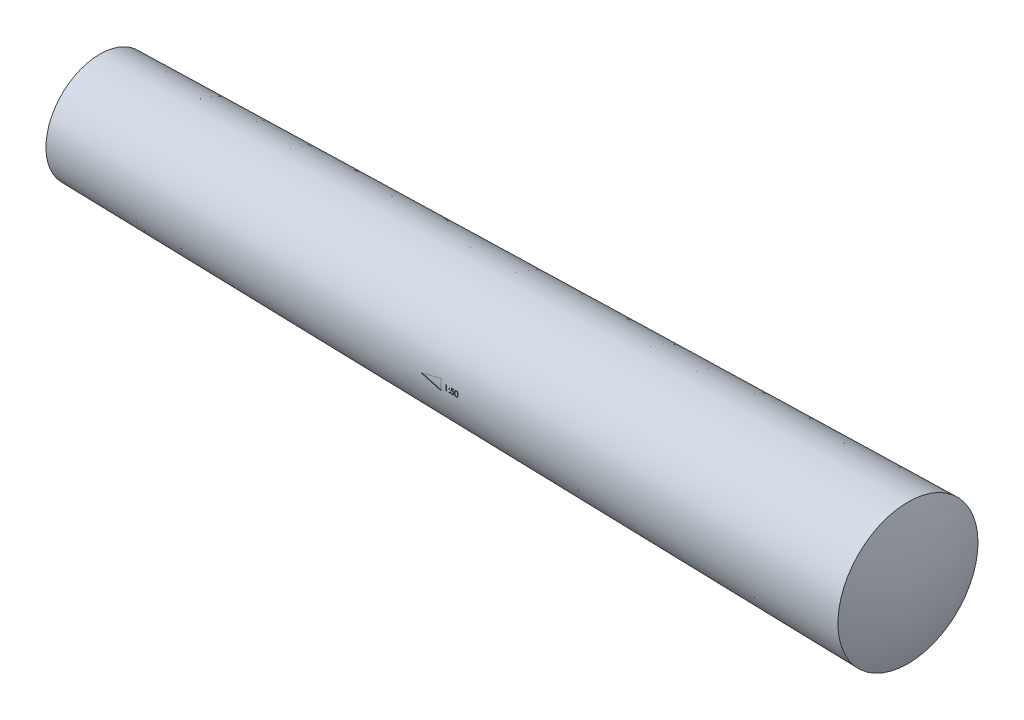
SolidWorks part; units mm, degrees
ref_plane "Front Plane" through (0, 0, 0) normal (0, 0, 1) x (1, 0, 0)
ref_plane "Top Plane" through (0, 0, 0) normal (0, 1, 0) x (1, 0, 0)
ref_plane "Right Plane" through (0, 0, 0) normal (1, 0, 0) x (0, 0, -1)
sketch "Sketch1" plane through (0, 0, 0) normal (1, 0, 0) x (0, 0, -1)
  circle A0 centre (0, 0) radius 10
  dimension "D1" = 20
extrude "Extrude1" add sketch "Sketch1" along normal mid plane 150
draft "Draft1" type of draft neutral plane draft angle 1.146 faces to draft 1 parameters "D1"=1.146
sketch "Sketch2" plane through (0, 0, 0) normal (0, 0, 1) x (1, 0, 0)
  line L0 (-75, 0) -> (-75, 10)
  line L1 (-75, 10) -> (-75, -10) construction
  line L2 (-75, 0) -> (-77.5, 0)
  line L3 (-77.5, 0) -> (-77.5, -11.5) construction
  line L4 (75, 0) -> (75, 13.0001)
  line L5 (75, -13.0001) -> (75, 13.0001) construction
  line L6 (75, 0) -> (77.5, 0)
  line L7 (77.5, 0) -> (77.5, -11.5) construction
  line L8 (-75, -10) -> (75, -13.0001) construction
  arc A0 (-77.5, 0) -> (-75, 10) centre (-56.25, 0) cw
  arc A1 (77.5, 0) -> (75, 13.0001) centre (42.4495, 0) ccw
  point P14 (0, -11.5)
revolve "Revolve1" add sketch "Sketch2" angle 360 about L2
sketch "Sketch5" plane through (0, 0, 0) normal (0, 0, 1) x (1, 0, 0)
  line L0 (0, 11.5) -> (0, -11.5) construction
  line L1 (75, 13.0001) -> (-75, 10) construction
  line L2 (-75, -10) -> (75, -13.0001) construction
ref_plane "Plane2" through (0, 0, 0) normal (-0.02, 0, 0.9998) x (0.9998, 0, 0.02)
sketch "Sketch6" plane through (0, 0, 0) normal (-0.02, 0, 0.9998) x (0.9998, 0, 0.02)
  line L0 (0, 0) -> (0, 1)
  line L1 (0, 11.5) -> (0, -11.5) construction
  line L2 (0, 1) -> (-3.7321, 0)
  line L3 (-3.7321, 0) -> (0, -1)
  line L4 (0, -1) -> (0, 0)
  line L5 (0, -0.5) -> (4, -0.5) construction
  text T0 "1:50" font "Century Gothic" height 1
  dimension "D1" = 2
  dimension "D2" = 30
  dimension "D3" = 4
wrap "Wrap2" sketch "Sketch6" wrap type deboss source sketch "Sketch6" thickness 0.1 parameters "D1"=0.1
equation "\"D2@Sketch2\" = \"D1@Sketch2\""
